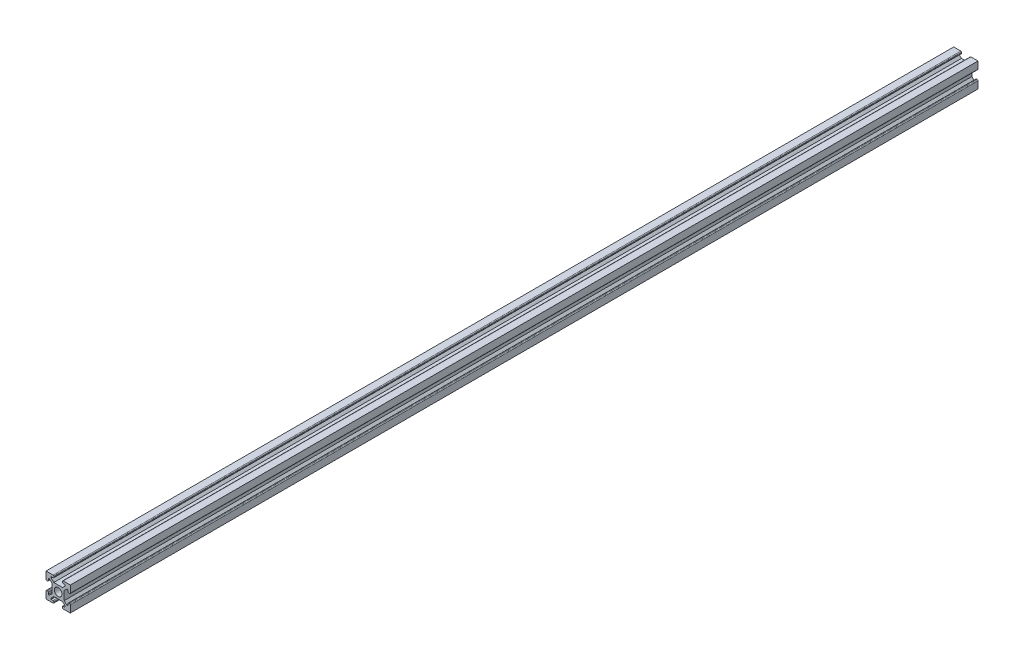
SolidWorks part; units mm, degrees
ref_plane "Front Plane" through (0, 0, 0) normal (0, 0, 1) x (1, 0, 0)
ref_plane "Top Plane" through (0, 0, 0) normal (0, 1, 0) x (1, 0, 0)
ref_plane "Right Plane" through (0, 0, 0) normal (1, 0, 0) x (0, 0, -1)
sketch "Sketch1" plane through (0, 0, 0) normal (0, 0, 1) x (1, 0, 0)
  line L0 (7.1042, 20.066) -> (7.1042, 16.256)
  line L1 (-20.066, 20.066) -> (20.066, 20.066)
  line L2 (-20.066, 20.066) -> (-20.066, -20.066)
  line L3 (-20.066, -20.066) -> (20.066, -20.066)
  line L4 (20.066, 20.066) -> (20.066, -20.066)
  line L5 (-20.066, 20.066) -> (20.066, -20.066) construction
  line L6 (-20.066, -20.066) -> (20.066, 20.066) construction
  line L7 (-10.033, 10.033) -> (10.033, 10.033)
  line L8 (-10.033, 10.033) -> (-10.033, -10.033)
  line L9 (-10.033, -10.033) -> (10.033, -10.033)
  line L10 (10.033, 10.033) -> (10.033, -10.033)
  line L11 (-10.033, 10.033) -> (10.033, -10.033) construction
  line L12 (-10.033, -10.033) -> (10.033, 10.033) construction
  line L13 (7.1042, 16.256) -> (11.6762, 16.256)
  line L14 (10.033, 7.2312) -> (14.478, 11.6762)
  line L15 (14.478, 11.6762) -> (16.256, 11.6762)
  line L16 (7.2312, 10.033) -> (11.6762, 14.478)
  line L17 (11.6762, 14.478) -> (11.6762, 16.256)
  line L18 (16.256, 7.1042) -> (16.256, 11.6762)
  line L19 (20.066, 7.1042) -> (16.256, 7.1042)
  line L20 (0, 20.066) -> (0, -20.066) construction
  line L21 (-20.066, 0) -> (20.066, 0) construction
  line L22 (-14.478, 11.6762) -> (-16.256, 11.6762)
  line L23 (-20.066, 7.1042) -> (-16.256, 7.1042)
  line L24 (-16.256, 7.1042) -> (-16.256, 11.6762)
  line L25 (-10.033, 7.2312) -> (-14.478, 11.6762)
  line L26 (-7.2312, 10.033) -> (-11.6762, 14.478)
  line L27 (-11.6762, 14.478) -> (-11.6762, 16.256)
  line L28 (-7.1042, 16.256) -> (-11.6762, 16.256)
  line L29 (-7.1042, 20.066) -> (-7.1042, 16.256)
  line L30 (20.066, -7.1042) -> (16.256, -7.1042)
  line L31 (16.256, -7.1042) -> (16.256, -11.6762)
  line L32 (14.478, -11.6762) -> (16.256, -11.6762)
  line L33 (10.033, -7.2312) -> (14.478, -11.6762)
  line L34 (7.2312, -10.033) -> (11.6762, -14.478)
  line L35 (11.6762, -14.478) -> (11.6762, -16.256)
  line L36 (7.1042, -16.256) -> (11.6762, -16.256)
  line L37 (7.1042, -20.066) -> (7.1042, -16.256)
  line L38 (-7.1042, -20.066) -> (-7.1042, -16.256)
  line L39 (-7.1042, -16.256) -> (-11.6762, -16.256)
  line L40 (-11.6762, -14.478) -> (-11.6762, -16.256)
  line L41 (-7.2312, -10.033) -> (-11.6762, -14.478)
  line L42 (-14.478, -11.6762) -> (-16.256, -11.6762)
  line L43 (-10.033, -7.2312) -> (-14.478, -11.6762)
  line L44 (-16.256, -7.1042) -> (-16.256, -11.6762)
  line L45 (-20.066, -7.1042) -> (-16.256, -7.1042)
  circle A0 centre (0, 0) radius 6.35
  point P0 (0, 0)
  point P6 (0, 0)
  point P16 (11.6762, 15.367)
  point P20 (15.367, 11.6762)
  dimension "D4" = 3.81
  dimension "D1" = 40.132
  dimension "D2" = 40.132
  dimension "D3" = 20.066
  dimension "D5" = 4.572
  dimension "D6" = 1.778
extrude "Boss-Extrude1" add sketch "Sketch1" along normal blind 1500 contours L29 L1 L2 L23 L24 L22 L25 L8 L7 L26 L27 L28 | L19 L4 L1 L0 L13 L17 L16 L7 L10 L14 L15 L18 | L10 L7 L8 L9 A0 | L37 L3 L4 L30 L31 L32 L33 L10 L9 L34 L35 L36 | L45 L2 L3 L38 L39 L40 L41 L9 L8 L43 L42 L44
fillet "Fillet1" radius 1.27 16 edges at (20.066, 7.1042, 750) (16.256, 7.1042, 750) (7.1042, 20.066, 750) (7.1042, 16.256, 750) (-7.1042, 16.256, 750) (-7.1042, 20.066, 750) (-16.256, 7.1042, 750) (-20.066, 7.1042, 750) (-20.066, -7.1042, 750) (-16.256, -7.1042, 750) (-7.1042, -20.066, 750) (-7.1042, -16.256, 750) (7.1042, -20.066, 750) (7.1042, -16.256, 750) (16.256, -7.1042, 750) (20.066, -7.1042, 750)
